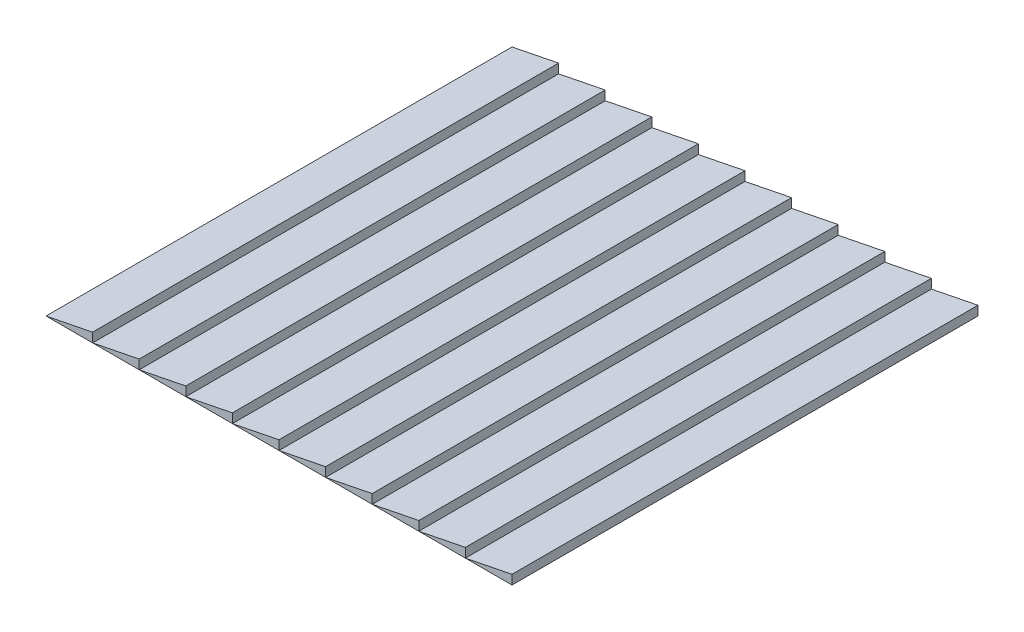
SolidWorks part; units mm, degrees
ref_plane "Front Plane" through (0, 0, 0) normal (0, 0, 1) x (1, 0, 0)
ref_plane "Top Plane" through (0, 0, 0) normal (0, 1, 0) x (1, 0, 0)
ref_plane "Right Plane" through (0, 0, 0) normal (1, 0, 0) x (0, 0, -1)
sketch "Sketch1" plane through (0, 0, 0) normal (0, 0, 1) x (1, 0, 0)
  line L0 (0, 0) -> (0, 20)
  line L1 (0, 20) -> (-100, 0)
  line L4 (0, 0) -> (-100, 0)
extrude "Boss-Extrude1" add sketch "Sketch1" against normal blind 1000 contours L1 L4 L0
ref_plane "Plane1" through (-1000, 0, 0) normal (1, 0, 0) x (0, 0, -1)
pattern_linear "LPattern1" count 10 spacing 100 along (-1, 0, 0) of "Boss-Extrude1"
equation "\"D3@LPattern1\"=\"D1@Sketch1\""
